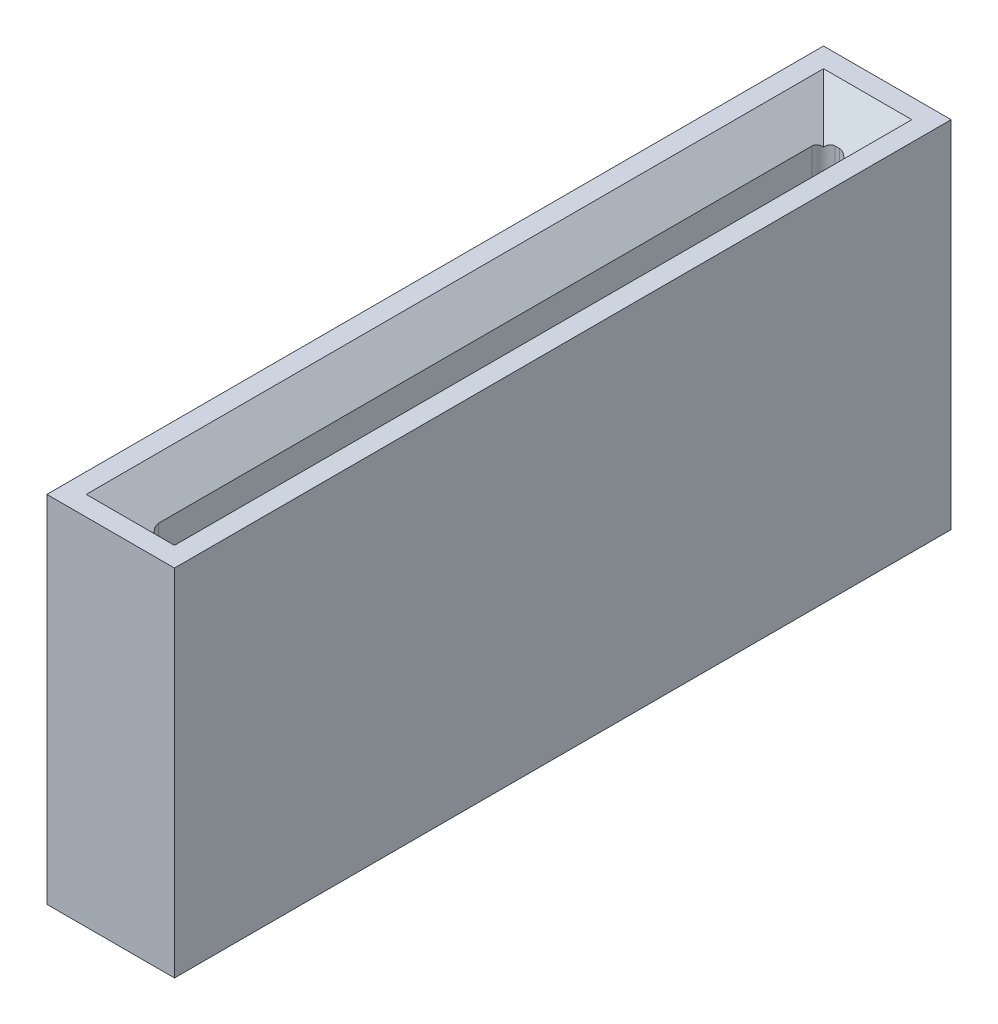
SolidWorks part; units mm, degrees
ref_plane "Front Plane" through (0, 0, 0) normal (1, 0, 0) x (0, 1, 0)
ref_plane "Top Plane" through (0, 0, 0) normal (0, 0, 1) x (0, 1, 0)
ref_plane "Right Plane" through (0, 0, 0) normal (0, 1, 0) x (-1, 0, 0)
sketch "sk 30x0.75in w weld" plane through (0, 0, 0) normal (0, 1, 0) x (-1, 0, 0)
  line L0 (-44.45, 415.925) -> (44.45, 415.925)
  line L1 (-9.525, 381) -> (9.525, 381)
  line L2 (-9.525, 381) -> (-9.525, -381)
  line L3 (-9.525, -381) -> (9.525, -381)
  line L4 (9.525, 381) -> (9.525, -381)
  line L5 (-9.525, 381) -> (9.525, -381) construction
  line L6 (-9.525, -381) -> (9.525, 381) construction
  line L7 (44.45, 415.925) -> (44.45, -415.925)
  line L8 (-44.45, -415.925) -> (44.45, -415.925)
  line L9 (-44.45, 415.925) -> (-44.45, -415.925)
  point P0 (0, 0)
  dimension "D1" = 19.05
  dimension "D2" = 762
  dimension "D3" = 34.925
sketch "sk block" plane through (0, 0, 0) normal (0, 1, 0) x (-1, 0, 0)
  line L8 (-15.525, 387) -> (-15.525, -387)
  line L9 (-15.525, -387) -> (15.525, -387)
  line L10 (15.525, -387) -> (15.525, 387)
  line L11 (15.525, 387) -> (-15.525, 387)
  line L12 (-15.525, 387) -> (-15.525, -387)
  line L13 (-15.525, -387) -> (15.525, -387)
  line L14 (15.525, -387) -> (15.525, 387)
  line L15 (15.525, 387) -> (-15.525, 387)
  line L20 (-73.025, 444.5) -> (-73.025, -444.5)
  line L21 (-73.025, -444.5) -> (73.025, -444.5)
  line L22 (73.025, -444.5) -> (73.025, 444.5)
  line L23 (73.025, 444.5) -> (-73.025, 444.5)
  line L24 (-73.025, 444.5) -> (-73.025, -444.5)
  line L25 (-73.025, -444.5) -> (73.025, -444.5)
  line L26 (73.025, -444.5) -> (73.025, 444.5)
  line L27 (73.025, 444.5) -> (-73.025, 444.5)
  dimension "D1" = 6
  dimension "D2" = 63.5
sketch "sk Holes" plane through (0, 0, 0) normal (0, 1, 0) x (-1, 0, 0)
  line L0 (-9.525, 381) -> (9.525, 381) construction
  line L1 (-9.525, -381) -> (9.525, -381) construction
  line L2 (-9.525, 381) -> (-9.525, -381) construction
  circle A0 centre (-76.2, 317.5) radius 15.875
  circle A1 centre (76.2, 317.5) radius 15.875
  circle A2 centre (-76.2, -317.5) radius 15.875
  circle A3 centre (76.2, -317.5) radius 15.875
  circle A4 centre (-76.2, 190.5) radius 15.875
  circle A5 centre (76.2, 190.5) radius 15.875
  circle A6 centre (-76.2, -190.5) radius 15.875
  circle A7 centre (76.2, -190.5) radius 15.875
  circle A8 centre (-76.2, 317.5) radius 34.925 construction
  circle A9 centre (76.2, 317.5) radius 34.925 construction
  point P10 (0, 381)
  point P23 (-41.275, 317.5)
  dimension "D1" = 31.75
  dimension "D2" = 31.75
  dimension "D6" = 31.75
  dimension "D7" = 31.75
  dimension "D11" = 69.85
  dimension "D12" = 69.85
  dimension "D13" = 31.75
  dimension "D3" = 63.5
  dimension "D4" = 76.2
  dimension "D5" = 76.2
  dimension "D8" = 63.5
  dimension "D9" = 2
  dimension "D10" = 2
extrude "Boss-Extrude1" add sketch "sk block" along normal mid plane 406.4
chamfer "Chamfer1" distance 35 angle 45 8 edges at (0, -203.2, 387) (-15.525, -203.2, 0) (0, -203.2, -387) (15.525, -203.2, 0) (0, 203.2, -387) (15.525, 203.2, 0) (0, 203.2, 387) (-15.525, 203.2, 0)
fillet "Fillet1" radius 13 4 edges at (-15.525, 0, 387) (15.525, 0, 387) (15.525, 0, -387) (-15.525, 0, -387)
